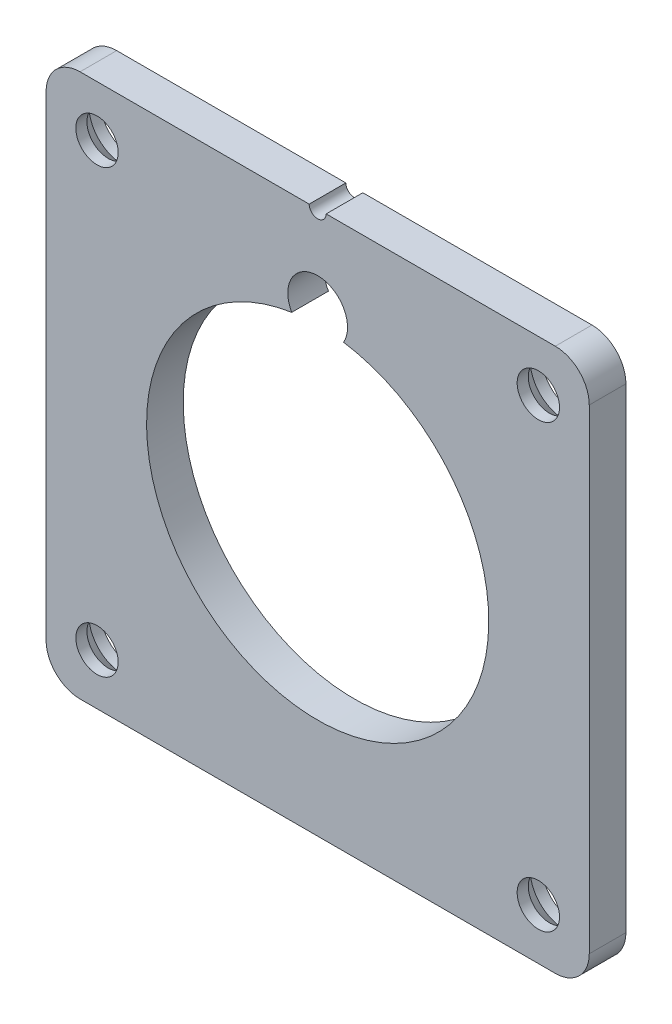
SolidWorks part; units mm, degrees
ref_plane "Front Plane" through (0, 0, 0) normal (0, 0, 1) x (1, 0, 0)
ref_plane "Top Plane" through (0, 0, 0) normal (0, 1, 0) x (1, 0, 0)
ref_plane "Right Plane" through (0, 0, 0) normal (1, 0, 0) x (0, 0, -1)
sketch "Sketch1" plane through (0, 0, 0) normal (0, 0, 1) x (1, 0, 0)
  line L2 (-50.8, 50.8) -> (50.8, 50.8)
  line L6 (-50.8, 50.8) -> (-50.8, -50.8)
  line L7 (-50.8, -50.8) -> (50.8, -50.8)
  line L8 (50.8, 50.8) -> (50.8, -50.8)
  dimension "D1" = 101.6
  dimension "D2" = 101.6
extrude "Boss-Extrude1" add sketch "Sketch1" along normal blind 6.858
fillet "Fillet1" radius 6.35 4 edges at (-50.8, -50.8, 3.429) (50.8, -50.8, 3.429) (50.8, 50.8, 3.429) (-50.8, 50.8, 3.429)
hole_wizard "CSK for 5/16 Flat Head Machine Screw1" positions "Sketch5" profile "Sketch6" countersink size "5/16" standard "ANSI Inch"
sketch "Sketch5" plane through (0, 0, 0) normal (0, 0, 1) x (1, 0, 0)
  line L1 (44.45, 50.8) -> (-44.45, 50.8) construction
  line L2 (50.8, -44.45) -> (50.8, 44.45) construction
  point P0 (41.275, 41.275)
  point P2 (-41.275, 41.275)
  point P4 (-41.275, -41.275)
  point P6 (41.275, -41.275)
  dimension "D1" = 82.55
  dimension "D2" = 9.525
  dimension "D3" = 9.525
  dimension "D4" = 82.55
sketch "Sketch6" plane through (41.275, 41.275, 0) normal (1, 0, 0) x (0, 1, 0)
  line L0 (0, 0) -> (0, 6.858)
  line L1 (0, 6.858) -> (3.9624, 6.858)
  line L2 (3.9624, 6.858) -> (3.9624, 4.7786)
  line L3 (3.9624, 4.7786) -> (6.35, 2.032)
  line L4 (6.35, 2.032) -> (6.35, 0)
  line L6 (6.35, 0) -> (0, 0)
  line L7 (-3.9624, 4.7786) -> (-6.35, 2.032) construction
  line L11 (0, -6.35) -> (0, 107.95) construction
  dimension "Thru Hole Dia." = 7.9248
  dimension "Thru Hole Depth" = 6.858
  dimension "C'Sink Dia." = 12.7
  dimension "C'Sink Angle" = 82
  dimension "Head Clearance" = 2.032
sketch "Sketch7" plane through (0, 0, 0) normal (0, 0, -1) x (-1, 0, 0)
  line L0 (-44.45, 50.8) -> (44.45, 50.8) construction
  circle A0 centre (0, 50.8) radius 1.5875
  dimension "D1" = 3.175
extrude "Cut-Extrude3" cut sketch "Sketch7" against normal through all
sketch "Sketch8" plane through (0, 0, 0) normal (0, 0, -1) x (-1, 0, 0)
  line L0 (0, 0) -> (0, 34.417) construction
  line L1 (-44.45, 50.8) -> (-1.5875, 50.8) construction
  arc A3 (-4.8462, 31.635) -> (4.8462, 31.635) centre (0, 0) ccw
  arc A4 (4.8462, 31.635) -> (-4.8462, 31.635) centre (0, 34.417) ccw
  dimension "D1" = 64.008
  dimension "D2" = 34.417
  dimension "D3" = 11.176
  dimension "D4" = 45.9538
  dimension "D5" = 16.383
extrude "Cut-Extrude8" cut sketch "Sketch8" against normal through all
